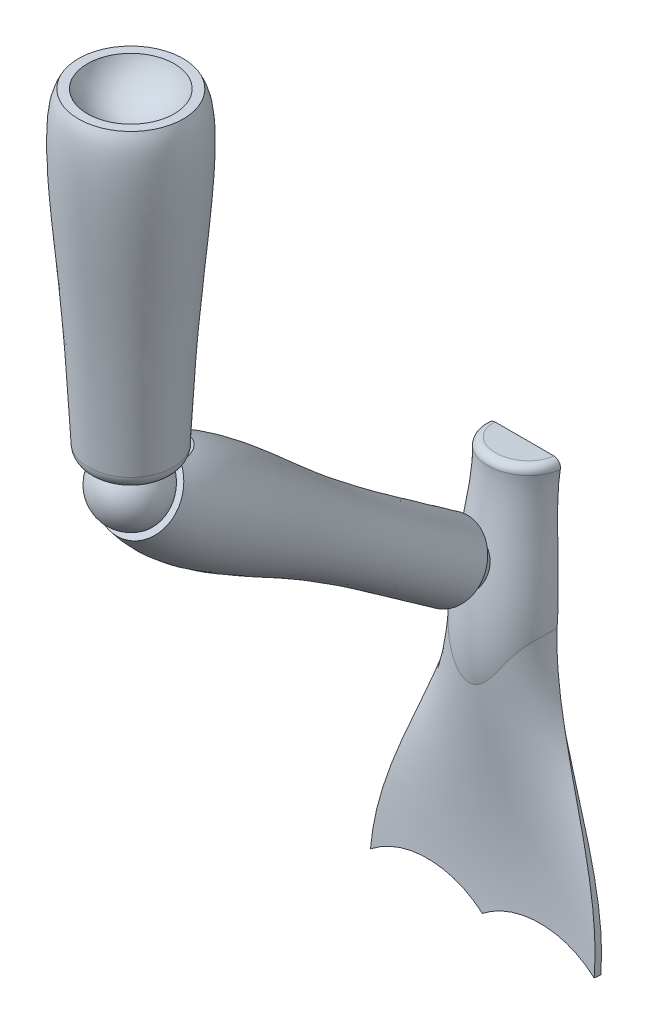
SolidWorks part; units mm, degrees
ref_plane "Plano frontal" through (0, 0, 0) normal (0, 0, 1) x (1, 0, 0)
ref_plane "Plano superior" through (0, 0, 0) normal (0, 1, 0) x (1, 0, 0)
ref_plane "Plano direito" through (0, 0, 0) normal (1, 0, 0) x (0, 0, -1)
imported_body "SW3dPS-manikin_Theigh-1-solid1"
imported_body "SW3dPS-manikin_Shin-1-solid1"
imported_body "SW3dPS-manikin_Foot-1-solid1"
combine bodies "Combinar1" operation type add bodies to combine 101 102 103
scale "Escala2" scale about centroid uniform scaling yes scale factor 6
